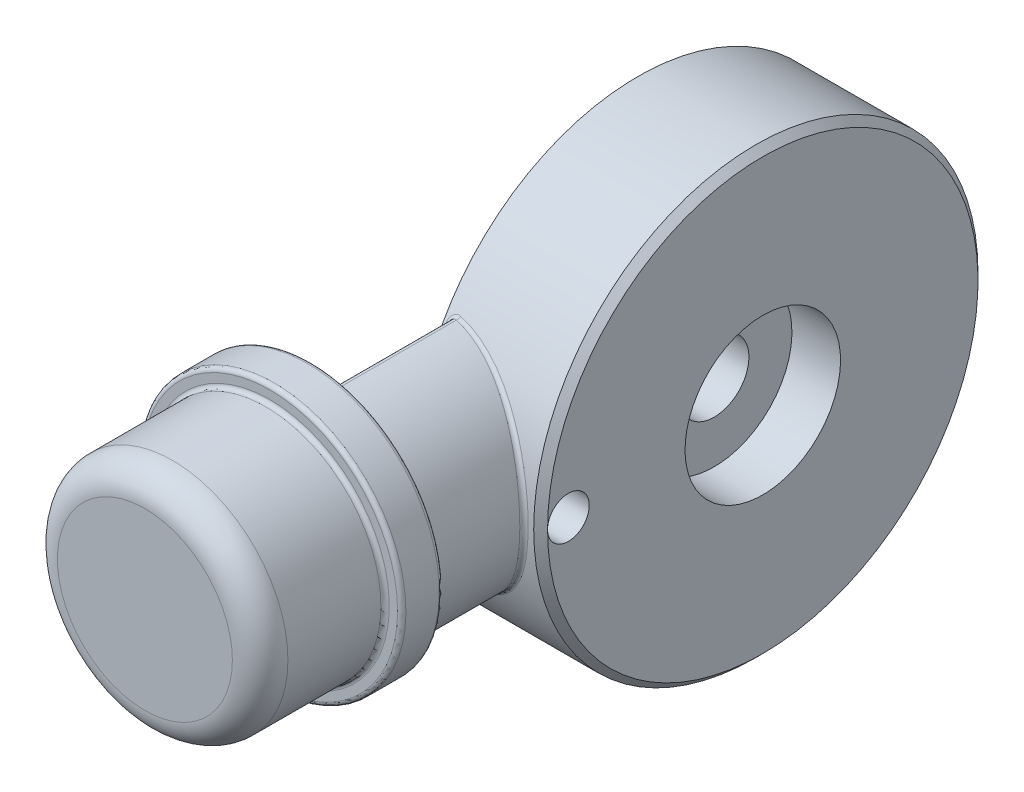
SolidWorks part; units mm, degrees
ref_plane "Plan de face" through (0, 0, 0) normal (0, 0, 1) x (1, 0, 0)
ref_plane "Plan de dessus" through (0, 0, 0) normal (0, 1, 0) x (1, 0, 0)
ref_plane "Plan de droite" through (0, 0, 0) normal (1, 0, 0) x (0, 0, -1)
imported_body "Importée5"
sketch "Esquisse1" plane through (1, 0, 0) normal (-1, 0, 0) x (0, 0, 1)
  circle A0 centre (0, 0) radius 16
extrude "Boss.-Extru.1" add sketch "Esquisse1" along normal blind 0.5
sketch "Esquisse2" plane through (8.3, 0, 0) normal (1, 0, 0) x (0, 0, -1)
  circle A0 centre (0, 0) radius 16
extrude "Boss.-Extru.2" add sketch "Esquisse2" along normal blind 1.2
sketch "Esquisse3" plane through (0.5, 0, 0) normal (-1, 0, 0) x (0, 0, 1)
  circle A0 centre (0, 0) radius 6.5
extrude "Boss.-Extru.3" add sketch "Esquisse3" along normal blind 5.25
sketch "Esquisse4" plane through (0, 0, 26) normal (0, 0, 1) x (1, 0, 0)
  circle A0 centre (0, 0) radius 8.3
extrude "Boss.-Extru.4" add sketch "Esquisse4" along normal blind 9
sketch "Esquisse5" plane through (0.5, 0, 0) normal (-1, 0, 0) x (0, 0, 1)
  arc A0 (0.5755, -8.2299) -> (-6.3199, 5.303) centre (0, 0) cw
  arc A1 (-6.3199, 5.303) -> (-10.9161, 9.1597) centre (-8.618, 7.2314) ccw
  arc A2 (-10.9161, 9.1597) -> (0.994, -14.2153) centre (0, 0) ccw
  arc A3 (0.994, -14.2153) -> (0.5755, -8.2299) centre (0.7848, -11.2226) ccw
extrude "Enlèv. mat.-Extru.1" cut sketch "Esquisse5" against normal blind 6
hole_wizard "Diamètre du perçage Ø3.0 (3)1" positions "Esquisse7" profile "Esquisse6" hole size "Ø3.0" standard "Ansi Metric"
sketch "Esquisse7" plane through (9.5, 0, 0) normal (1, 0, 0) x (0, 0, -1)
  point P0 (-14, 0)
sketch "Esquisse6" plane through (9.5, 0, 14) normal (0, 1, 0) x (0, 0, -1)
  line L0 (0, 0) -> (0, 19)
  line L1 (0, 19) -> (1.5, 19)
  line L2 (1.5, 19) -> (1.5, 0)
  line L5 (1.5, 0) -> (0, 0)
  line L11 (0, -6.35) -> (0, 107.95) construction
  dimension "Diamètre du perçage jusqu'au prochain" = 3
  dimension "Profondeur du perçage jusqu'au prochain" = 19
hole_wizard "Diamètre du perçage Ø5.0 (5)1" positions "Esquisse9" profile "Esquisse8" hole size "Ø5.0" standard "Ansi Metric"
sketch "Esquisse9" plane through (9.5, 0, 0) normal (1, 0, 0) x (0, 0, -1)
  point P0 (0, 0)
sketch "Esquisse8" plane through (9.5, 0, 0) normal (0, 1, 0) x (0, 0, -1)
  line L0 (0, 0) -> (0, 19)
  line L1 (0, 19) -> (2.5, 19)
  line L2 (2.5, 19) -> (2.5, 0)
  line L5 (2.5, 0) -> (0, 0)
  line L11 (0, -6.35) -> (0, 107.95) construction
  dimension "Diamètre du perçage jusqu'au prochain" = 5
  dimension "Profondeur du perçage jusqu'au prochain" = 19
chamfer "Chanfrein1" distance 0.5 angle 45 1 edges at (9.5, 16, 0)
chamfer "Chanfrein2" distance 0.3 angle 45 1 edges at (-4.75, -6.5, 0)
fillet "Congé1" radius 0.3 9 edges at (1, -8.2395, 18.3577) (1, 8.2395, 18.3577) (8.3, 0, 23) (1, 0, 23) (8.2813, 0.5567, 15.9903) (1, 0, 16) (0, -9.5, 23) (0, -9.5, 26) (8.3, 0, 26)
fillet "Congé2" radius 2 1 edges at (8.3, 0, 35)
sketch "Esquisse10" plane through (0.5, 0, 0) normal (-1, 0, 0) x (0, 0, 1)
  line L0 (0, 0) -> (-8.618, 7.2314) construction
  line L1 (0, 0) -> (0.7848, -11.2226) construction
sketch "Esquisse11" plane through (9.5, 0, 0) normal (1, 0, 0) x (0, 0, -1)
  circle A0 centre (0, 0) radius 5.6
  dimension "D1" = 11.2
extrude "Enlèv. mat.-Extru.2" cut sketch "Esquisse11" against normal blind 3.5
